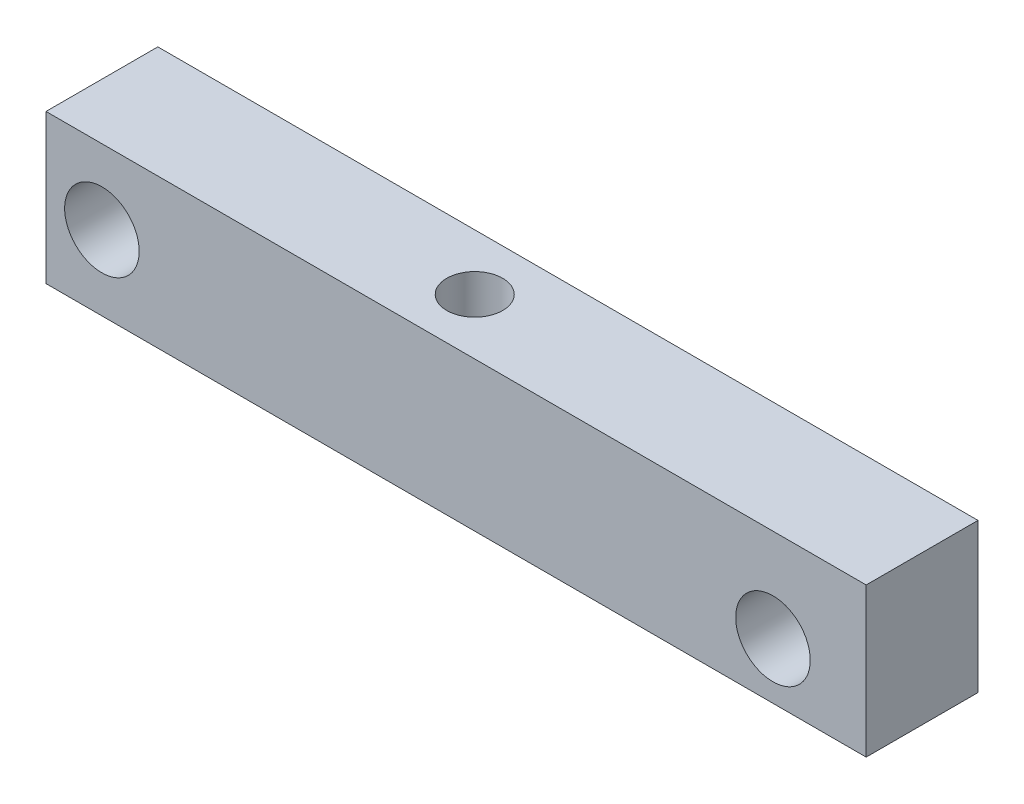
SolidWorks part; units mm, degrees
ref_plane "Alzado" through (0, 0, 0) normal (0, 0, 1) x (1, 0, 0)
ref_plane "Planta" through (0, 0, 0) normal (0, 1, 0) x (1, 0, 0)
ref_plane "Vista lateral" through (0, 0, 0) normal (1, 0, 0) x (0, 0, -1)
sketch "Croquis1" plane through (0, 0, 0) normal (0, 0, 1) x (1, 0, 0)
  line L1 (-11, -2) -> (11, -2)
  line L2 (-11, -2) -> (-11, 2)
  line L3 (-11, 2) -> (11, 2)
  line L4 (11, -2) -> (11, 2)
  line L5 (-11, -2) -> (11, 2) construction
  line L6 (-11, 2) -> (11, -2) construction
  point P0 (0, 0)
  dimension "D1" = 22
  dimension "D2" = 4
extrude "Saliente-Extruir1" add sketch "Croquis1" along normal blind 3
sketch "Croquis2" plane through (0, 2, 0) normal (0, 1, 0) x (1, 0, 0)
  line L0 (-11, -1.5) -> (11, -1.5) construction
  line L5 (-11, -3) -> (-11, 0) construction
  line L6 (11, -3) -> (11, 0) construction
  circle A0 centre (-1, -1.5) radius 0.75
  dimension "D1" = 1.5
  dimension "D2" = 12
extrude "Cortar-Extruir1" cut sketch "Croquis2" against normal blind 3
sketch "Croquis3" plane through (0, 0, 3) normal (0, 0, 1) x (1, 0, 0)
  line L0 (-11, 2) -> (-8, -2) construction
  line L1 (-11, -2) -> (11, -2) construction
  line L2 (-11, 2) -> (-11, -2) construction
  line L3 (6, 1) -> (11, -2) construction
  circle A0 centre (8.5, -0.5) radius 1
  circle A1 centre (-9.5, 0) radius 1
  dimension "D4" = 2
  dimension "D5" = 2
  dimension "D1" = 3
  dimension "D2" = 5
  dimension "D3" = 3
extrude "Cortar-Extruir2" cut sketch "Croquis3" against normal up to next
